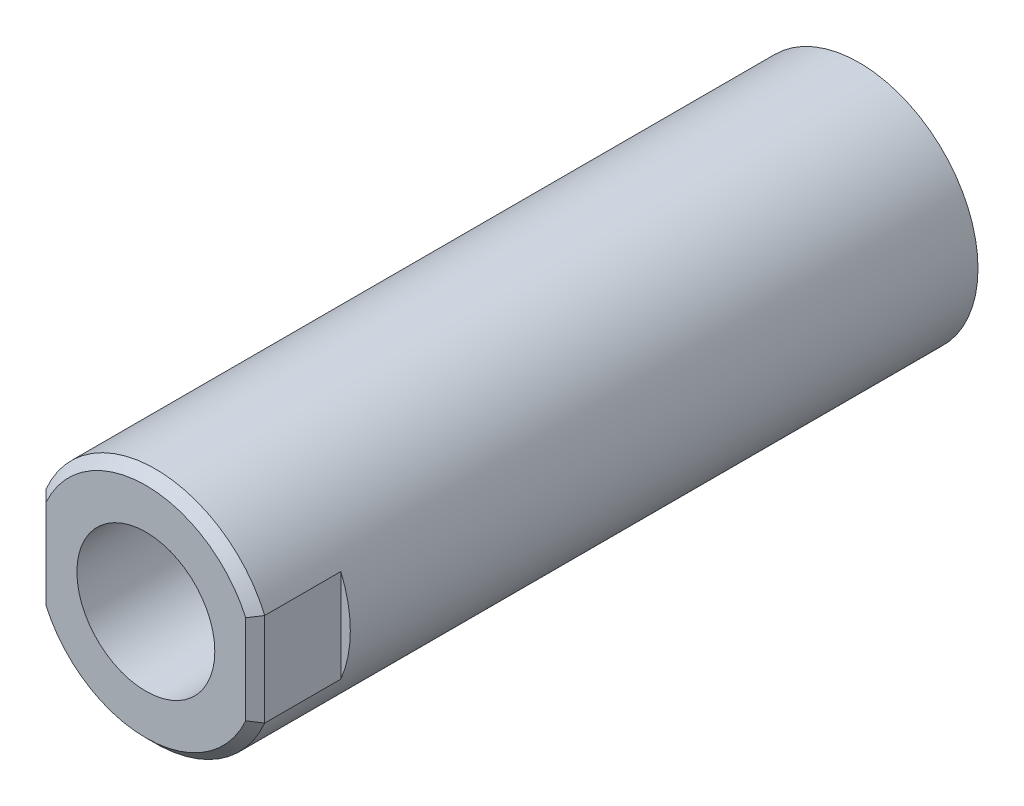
SolidWorks part; units mm, degrees
ref_plane "Front Plane" through (0, 0, 0) normal (0, 0, 1) x (1, 0, 0)
ref_plane "Top Plane" through (0, 0, 0) normal (0, 1, 0) x (1, 0, 0)
ref_plane "Right Plane" through (0, 0, 0) normal (1, 0, 0) x (0, 0, -1)
sketch "Sketch1" plane through (0, 0, 0) normal (0, 0, 1) x (1, 0, 0)
  circle A0 centre (0, 0) radius 12.5
  dimension "D1" = 25
extrude "S" add sketch "Sketch1" against normal blind 75
sketch "Sketch2" plane through (0, 0, 0) normal (0, 0, 1) x (1, 0, 0)
  circle A0 centre (0, 0) radius 12.5
  circle A1 centre (0, 0) radius 12.5 construction
  dimension "D1" = 25
extrude "L2" add sketch "Sketch2" along normal blind 12
hole_wizard "( T1xL4 ) M16x1.25 Tapped Hole1 " positions "3DSketch1" profile "Sketch5" tap size "M16x1.5" standard "Ansi Metric"
sketch3d "3DSketch1"
  circle A0 centre (0, 0, 12) radius 12.5 construction
  point P0 (0, 0, 12)
  point P5 (0, 0, 24.5)
sketch "Sketch5" plane through (0, 0, 12) normal (1, 0, 0) x (0, -1, 0)
  line L0 (0, 0) -> (0, 33.8562)
  line L1 (0, 33.8562) -> (7.25, 29.5)
  line L2 (7.25, 29.5) -> (7.25, 0)
  line L5 (7.25, 0) -> (0, 0)
  line L10 (0, 33.8562) -> (-7.25, 29.5) construction
  line L11 (0, -6.35) -> (0, 107.95) construction
  dimension "Tap Drill Dia." = 14.5
  dimension "Tap Drill Depth" = 29.5
  dimension "Drill Angle" = 118
chamfer "Chamfer2" distance 0.5 angle 45 1 edges at (12.5, 0, 12)
sketch "Sketch6" plane through (0, 0, 0) normal (0, 0, 1) x (1, 0, 0)
  circle A0 centre (0, 0) radius 12
  circle A1 centre (0, 0) radius 12.5
  circle A2 centre (0, 0) radius 12.5 construction
  circle A4 centre (0, 0) radius 12.5 construction
  dimension "D1" = 25
  dimension "D2" = 24
  dimension "D3" = 25
extrude "U/C" cut sketch "Sketch6" along normal blind 1
sketch "Sketch7" plane through (0, 0, 0) normal (0, 1, 0) x (1, 0, 0)
  line L1 (11.5, 0) -> (14, 0)
  line L2 (11.5, 0) -> (11.5, 9)
  line L3 (11.5, 9) -> (14, 9)
  line L4 (14, 0) -> (14, 9)
  line L5 (-14, 0) -> (-11.5, 0)
  line L6 (-14, 0) -> (-14, 9)
  line L7 (-14, 9) -> (-11.5, 9)
  line L8 (-11.5, 0) -> (-11.5, 9)
  line L12 (0, -1) -> (0, -11.5) construction
  line L13 (-12.5, 75) -> (12.5, 75) construction
  line L14 (0, 0) -> (0, -12) construction
  line L15 (0, 17.5) -> (0, -12) construction
  line L16 (-12, -12) -> (12, -12) construction
  dimension "D1" = 9
  dimension "D2" = 23
  dimension "D3" = 11.5
  dimension "D4" = 28
  dimension "D5" = 14
  dimension "D6" = 25
  dimension "D7" = 12
extrude "A/F" cut sketch "Sketch7" against normal mid plane 21
sketch "Sketch8" plane through (0, 0, 0) normal (0, 1, 0) x (1, 0, 0)
  line L1 (-21.5042, 0) -> (37.039, 0)
  line L2 (-21.5042, 0) -> (-21.5042, -18.3605)
  line L3 (-21.5042, -18.3605) -> (37.039, -18.3605)
  line L4 (37.039, 0) -> (37.039, -18.3605)
extrude "Cut-Extrude1" cut sketch "Sketch8" against normal mid plane 50
chamfer "Chamfer3" distance 1 angle 45 4 edges at (11.5, 0, 0) (0, 12.5, 0) (0, -12.5, 0) (-11.5, 0, 0)
equation "\"D2@Sketch6\" =\"D3@Sketch6\" - 1"
equation "\"D1@Sketch6\" = \"D3@Sketch6\""
equation "\"D2@Sketch7\" = \"D6@Sketch7\" - 2"
equation "\"D3@Sketch7\" = \"D2@Sketch7\" / 2"
equation "\"D4@Sketch7\" = \"D2@Sketch7\"+5"
equation "\"D5@Sketch7\" = \"D4@Sketch7\"/2"
equation "\"D1@Sketch7\" = \"D7@Sketch7\"-3"
